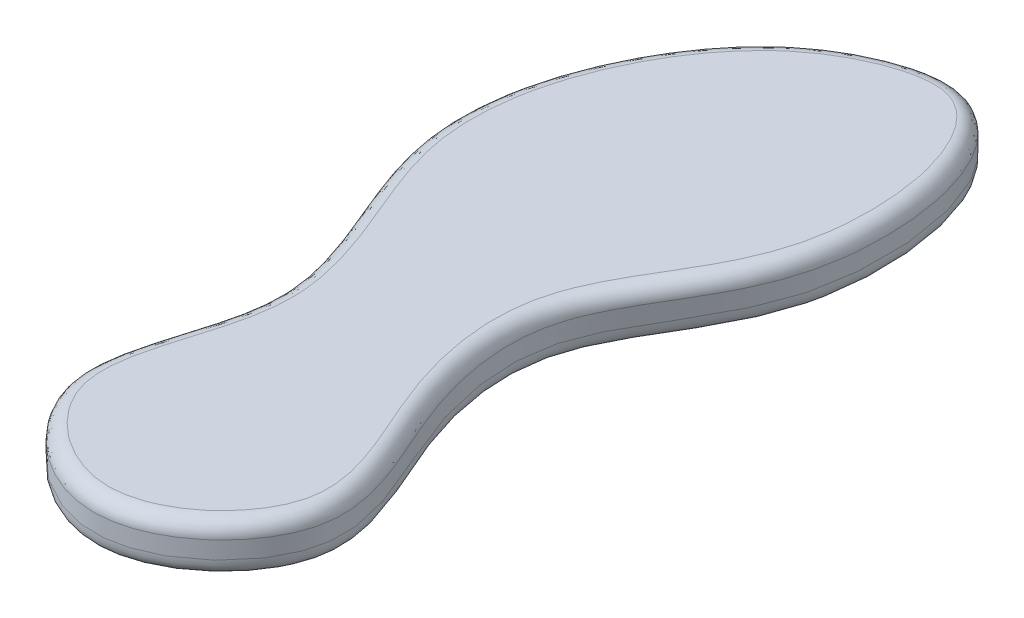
SolidWorks part; units mm, degrees
ref_plane "Front Plane" through (0, 0, 0) normal (0, 0, 1) x (1, 0, 0)
ref_plane "Top Plane" through (0, 0, 0) normal (0, 1, 0) x (1, 0, 0)
ref_plane "Right Plane" through (0, 0, 0) normal (1, 0, 0) x (0, 0, -1)
imported_body "Imported1"
fillet "Fillet1" radius 4
fillet "Fillet2" radius 4 15 edges at (-33.9993, 0, -35.0952) (-34.404, 0, -30.2955) (-33.4009, 0, -32.6953) (-34.5976, 0.5, -35.0952) (-33.9993, 1, -35.0952) (-33.4009, 0.5, -35.0952) (-33.4009, 1, -32.6953) (-33.4009, 0.5, -30.2955) (-34.404, 1, -30.2955) (-35.407, 0.5, -30.2955) (35.776, 0, 89.5422) (-29.1052, -33.9673, -52.4007)
